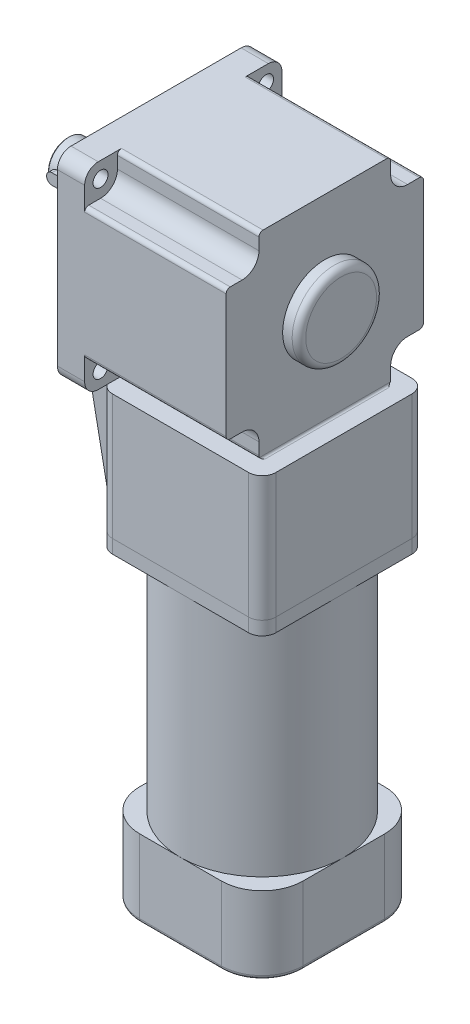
SolidWorks part; units mm, degrees
ref_plane "前视基准面" through (0, 0, 0) normal (0, 0, 1) x (1, 0, 0)
ref_plane "上视基准面" through (0, 0, 0) normal (0, 1, 0) x (1, 0, 0)
ref_plane "右视基准面" through (0, 0, 0) normal (1, 0, 0) x (0, 0, -1)
sketch "草图1" plane through (0, 0, 0) normal (1, 0, 0) x (0, 0, -1)
  line L1 (-62.5, -72.5) -> (62.5, -72.5)
  line L2 (-72.5, -62.5) -> (-72.5, 62.5)
  line L3 (-62.5, 72.5) -> (62.5, 72.5)
  line L4 (72.5, -62.5) -> (72.5, 62.5)
  line L5 (-72.5, -72.5) -> (72.5, 72.5) construction
  line L6 (-72.5, 72.5) -> (72.5, -72.5) construction
  arc A0 (62.5, 72.5) -> (72.5, 62.5) centre (62.5, 62.5) cw
  arc A1 (62.5, -72.5) -> (72.5, -62.5) centre (62.5, -62.5) ccw
  arc A2 (-62.5, -72.5) -> (-72.5, -62.5) centre (-62.5, -62.5) cw
  arc A3 (-72.5, 62.5) -> (-62.5, 72.5) centre (-62.5, 62.5) cw
  point P0 (0, 0)
  dimension "D1" = 10
extrude "凸台-拉伸1" add sketch "草图1" along normal blind 124
sketch "草图2" plane through (124, 0, 0) normal (1, 0, 0) x (0, 0, -1)
  line L0 (-60.8, 48.3958) -> (-69.5, 48.3958)
  line L1 (-72.5, -62.5) -> (-72.5, -45.3958)
  line L3 (-62.5, 72.5) -> (-45.3958, 72.5)
  line L5 (72.5, 62.5) -> (72.5, 45.3958)
  line L6 (-45.3958, -72.5) -> (-62.5, -72.5)
  line L7 (-72.5, 62.5) -> (-72.5, -62.5) construction
  line L8 (45.3958, 72.5) -> (62.5, 72.5)
  line L9 (-69.5, -48.3958) -> (-60.8, -48.3958)
  line L10 (62.5, -72.5) -> (45.3958, -72.5)
  line L11 (-48.3958, -60.8) -> (-48.3958, -69.5)
  line L12 (-62.5, -72.5) -> (62.5, -72.5) construction
  line L13 (72.5, -45.3958) -> (72.5, -62.5)
  line L14 (48.3958, -69.5) -> (48.3958, -60.8)
  line L15 (-72.5, 45.3958) -> (-72.5, 62.5)
  line L16 (60.8, -48.3958) -> (69.5, -48.3958)
  line L17 (72.5, -62.5) -> (72.5, 62.5) construction
  line L19 (69.5, 48.3958) -> (60.8, 48.3958)
  line L21 (48.3958, 60.8) -> (48.3958, 69.5)
  line L22 (62.5, 72.5) -> (-62.5, 72.5) construction
  line L24 (-48.3958, 69.5) -> (-48.3958, 60.8)
  arc A0 (-60.8, 48.3958) -> (-48.3958, 60.8) centre (-60.8, 60.8) ccw
  arc A1 (48.3958, 60.8) -> (60.8, 48.3958) centre (60.8, 60.8) ccw
  arc A2 (60.8, -48.3958) -> (48.3958, -60.8) centre (60.8, -60.8) ccw
  arc A3 (-48.3958, -60.8) -> (-60.8, -48.3958) centre (-60.8, -60.8) ccw
  arc A4 (-45.3958, 72.5) -> (-48.3958, 69.5) centre (-45.3958, 69.5) ccw
  arc A5 (48.3958, 69.5) -> (45.3958, 72.5) centre (45.3958, 69.5) ccw
  arc A6 (72.5, 45.3958) -> (69.5, 48.3958) centre (69.5, 45.3958) ccw
  arc A7 (69.5, -48.3958) -> (72.5, -45.3958) centre (69.5, -45.3958) ccw
  arc A8 (45.3958, -72.5) -> (48.3958, -69.5) centre (45.3958, -69.5) ccw
  arc A9 (-48.3958, -69.5) -> (-45.3958, -72.5) centre (-45.3958, -69.5) ccw
  arc A10 (-72.5, -45.3958) -> (-69.5, -48.3958) centre (-69.5, -45.3958) ccw
  arc A11 (-69.5, 48.3958) -> (-72.5, 45.3958) centre (-69.5, 45.3958) ccw
  arc A12 (-62.5, 72.5) -> (-72.5, 62.5) centre (-62.5, 62.5) ccw
  arc A13 (72.5, 62.5) -> (62.5, 72.5) centre (62.5, 62.5) ccw
  arc A14 (-72.5, -62.5) -> (-62.5, -72.5) centre (-62.5, -62.5) ccw
  arc A15 (62.5, -72.5) -> (72.5, -62.5) centre (62.5, -62.5) ccw
  point P0 (0, 0)
  point P8 (-48.3958, 72.5)
  point P35 (48.3958, 72.5)
  point P38 (72.5, 48.3958)
  point P41 (72.5, -48.3958)
  point P44 (48.3958, -72.5)
  point P47 (-48.3958, -72.5)
  point P50 (-72.5, -48.3958)
  point P53 (-72.5, 48.3958)
  dimension "D1" = 3
extrude "切除-拉伸1" cut sketch "草图2" against normal blind 104
sketch "草图3" plane through (0, 0, 0) normal (-1, 0, 0) x (0, 0, 1)
  circle A0 centre (-60.8, 60.8) radius 5.5
  circle A1 centre (60.8, 60.8) radius 5.5
  circle A2 centre (60.8, -60.8) radius 5.5
  circle A3 centre (-60.8, -60.8) radius 5.5
  point P0 (0, 0)
extrude "切除-拉伸2" cut sketch "草图3" against normal blind 20
sketch "草图4" plane through (0, 0, 0) normal (-1, 0, 0) x (0, 0, 1)
  line L9 (-47.2986, 61.204) -> (-66.9163, 3.204)
  line L10 (-37.8258, 68) -> (37.8258, 68)
  line L11 (47.2986, 61.204) -> (66.9163, 3.204)
  line L13 (-47.2986, -61.204) -> (-66.9163, -3.204)
  line L14 (-37.8258, -68) -> (37.8258, -68)
  line L15 (47.2986, -61.204) -> (66.9163, -3.204)
  arc A0 (37.8258, 68) -> (47.2986, 61.204) centre (37.8258, 58) cw
  arc A1 (66.9163, -3.204) -> (66.9163, 3.204) centre (57.4435, 0) ccw
  arc A2 (37.8258, -68) -> (47.2986, -61.204) centre (37.8258, -58) ccw
  arc A3 (-47.2986, -61.204) -> (-37.8258, -68) centre (-37.8258, -58) ccw
  arc A4 (-66.9163, -3.204) -> (-66.9163, 3.204) centre (-57.4435, 0) cw
  arc A5 (-37.8258, 68) -> (-47.2986, 61.204) centre (-37.8258, 58) ccw
  dimension "D1" = 10
extrude "切除-拉伸3" cut sketch "草图4" against normal blind 1
fillet "圆角2" radius 1 12 edges at (1, 66.1253, -43.655) (1, 68, 0) (1, 66.1253, 43.655) (1, 32.204, 57.1075) (1, 0, 67.4435) (1, -32.204, 57.1075) (1, -66.1253, 43.655) (1, -68, 0) (1, -66.1253, -43.655) (1, -32.204, -57.1075) (1, 0, -67.4435) (1, 32.204, -57.1075)
sketch "草图5" plane through (1, 0, 0) normal (-1, 0, 0) x (0, 0, 1)
  circle A0 centre (0, 0) radius 27.5
extrude "凸台-拉伸2" add sketch "草图5" along normal blind 4
sketch "草图6" plane through (-3, 0, 0) normal (-1, 0, 0) x (0, 0, 1)
  circle A0 centre (0, 0) radius 22.5
extrude "凸台-拉伸3" add sketch "草图6" along normal blind 12 separate body
fillet "圆角3" radius 1 1 edges at (-3, 0, 27.5)
fillet "圆角4" radius 1.5 1 edges at (-15, 0, 22.5)
sketch "草图7" plane through (-15, 0, 0) normal (-1, 0, 0) x (0, 0, 1)
  circle A0 centre (0, 0) radius 15
extrude "凸台-拉伸4" add sketch "草图7" along normal blind 1.5
fillet "圆角5" radius 1.5 1 edges at (-15, 0, 15)
sketch "草图8" plane through (-16.5, 0, 0) normal (-1, 0, 0) x (0, 0, 1)
  circle A0 centre (0, 0) radius 15
extrude "凸台-拉伸5" add sketch "草图8" along normal blind 48.5
ref_plane "基准面1" through (0, 0, 15) normal (0, 0, 1) x (1, 0, 0)
sketch "草图9" plane through (0, 0, 15) normal (0, 0, 1) x (1, 0, 0)
  line L3 (-58.5, 4) -> (-21.5, 4)
  line L5 (-21.5, -4) -> (-58.5, -4)
  arc A0 (-58.5, 4) -> (-58.5, -4) centre (-58.5, 0) ccw
  arc A1 (-21.5, -4) -> (-21.5, 4) centre (-21.5, 0) ccw
extrude "切除-拉伸4" cut sketch "草图9" against normal blind 5
sketch "草图10" plane through (0, 0, 10) normal (0, 0, 1) x (1, 0, 0)
  line L0 (-58.5, 4) -> (-21.5, 4)
  line L2 (-21.5, -4) -> (-58.5, -4)
  arc A0 (-58.5, 4) -> (-58.5, -4) centre (-58.5, 0) ccw
  arc A1 (-21.5, -4) -> (-21.5, 4) centre (-21.5, 0) ccw
extrude "凸台-拉伸6" add sketch "草图10" along normal blind 8 separate body
chamfer "倒角1" distance 1 angle 45 1 edges at (-65, 0, 15)
sketch "草图11" plane through (0, -72.5, 0) normal (0, -1, 0) x (1, 0, 0)
  line L3 (28, -60) -> (128, -60)
  line L4 (18, -50) -> (18, 50)
  line L5 (28, 60) -> (128, 60)
  line L6 (138, -50) -> (138, 50)
  line L7 (18, -60) -> (138, 60) construction
  line L8 (18, 60) -> (138, -60) construction
  arc A0 (28, -60) -> (18, -50) centre (28, -50) cw
  arc A1 (128, -60) -> (138, -50) centre (128, -50) ccw
  arc A2 (128, 60) -> (138, 50) centre (128, 50) cw
  arc A3 (18, 50) -> (28, 60) centre (28, 50) cw
  point P3 (78, 0)
  dimension "D1" = 10
extrude "凸台-拉伸7" add sketch "草图11" along normal blind 92
fillet "圆角8" radius 1.5 1 edges at (124, -72.5, 0)
ref_plane "基准面2" through (0, 0, 50) normal (0, 0, 1) x (1, 0, 0)
ref_plane "基准面3" through (0, 0, -50) normal (0, 0, 1) x (1, 0, 0)
sketch "草图12" plane through (0, 0, 50) normal (0, 0, 1) x (1, 0, 0)
  line L0 (18, -72.5) -> (0, -72.5)
  line L1 (0, -72.5) -> (18, -164.5)
  line L2 (18, -164.5) -> (18, -72.5)
extrude "凸台-拉伸8" add sketch "草图12" against normal blind 15
sketch "草图14" plane through (0, 0, -50) normal (0, 0, 1) x (1, 0, 0)
  line L0 (18, -72.5) -> (0, -72.5)
  line L1 (0, -72.5) -> (18, -164.5)
  line L2 (18, -164.5) -> (18, -72.5)
extrude "凸台-拉伸9" add sketch "草图14" along normal blind 15
sketch "草图15" plane through (0, -164.5, 0) normal (0, -1, 0) x (1, 0, 0)
  line L4 (28, -60) -> (128, -60)
  line L5 (18, -50) -> (18, 50)
  line L6 (28, 60) -> (128, 60)
  line L7 (138, -50) -> (138, 50)
  line L8 (18, -60) -> (138, 60) construction
  line L9 (18, 60) -> (138, -60) construction
  arc A0 (128, -60) -> (138, -50) centre (128, -50) ccw
  arc A1 (28, -60) -> (18, -50) centre (28, -50) cw
  arc A2 (18, 50) -> (28, 60) centre (28, 50) cw
  arc A3 (128, 60) -> (138, 50) centre (128, 50) cw
  point P6 (78, 0)
  dimension "D1" = 10
extrude "凸台-拉伸10" add sketch "草图15" along normal blind 10 separate body
sketch "草图16" plane through (0, -174.5, 0) normal (0, -1, 0) x (1, 0, 0)
  circle A0 centre (78, 0) radius 60
extrude "凸台-拉伸11" add sketch "草图16" along normal blind 168 separate body
sketch "草图17" plane through (0, -342.5, 0) normal (0, -1, 0) x (1, 0, 0)
  line L1 (48, -60) -> (108, -60)
  line L2 (18, -30) -> (18, 30)
  line L3 (48, 60) -> (108, 60)
  line L4 (138, -30) -> (138, 30)
  line L5 (18, -60) -> (138, 60) construction
  line L6 (18, 60) -> (138, -60) construction
  arc A0 (108, 60) -> (138, 30) centre (108, 30) cw
  arc A1 (18, 30) -> (48, 60) centre (48, 30) cw
  arc A2 (108, -60) -> (138, -30) centre (108, -30) ccw
  arc A3 (48, -60) -> (18, -30) centre (48, -30) cw
  point P0 (78, 0)
  dimension "D1" = 30
  dimension "D2" = 30
extrude "凸台-拉伸13" add sketch "草图17" along normal blind 57
fillet "圆角9" radius 3 8 edges at (138, -399.5, 0) (129.2132, -399.5, -51.2132) (78, -399.5, -60) (26.7868, -399.5, -51.2132) (18, -399.5, 0) (26.7868, -399.5, 51.2132) (78, -399.5, 60) (129.2132, -399.5, 51.2132)
sketch "草图19" plane through (124, 0, 0) normal (1, 0, 0) x (0, 0, -1)
  circle A0 centre (0, 0) radius 31
extrude "凸台-拉伸14" add sketch "草图19" along normal blind 12
fillet "圆角10" radius 5 1 edges at (136, 0, -31)
